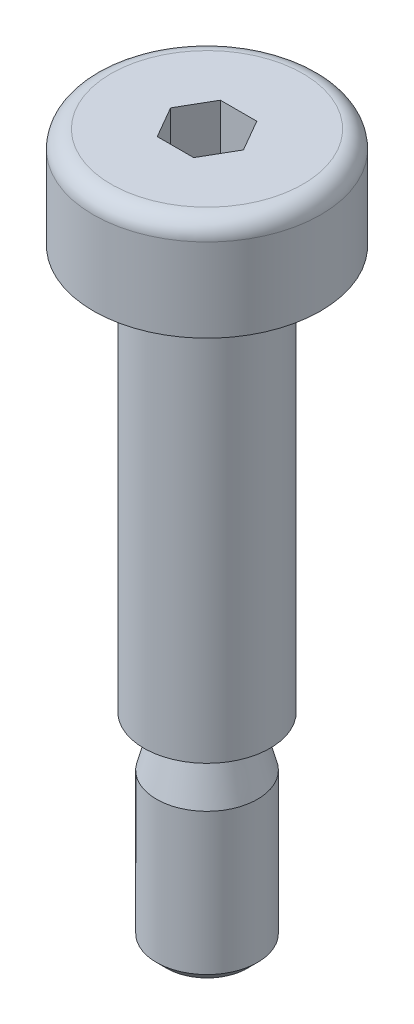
SolidWorks part; units mm, degrees
ref_plane "Aufriss" through (0, 0, 0) normal (0, 0, 1) x (1, 0, 0)
ref_plane "Grundriss" through (0, 0, 0) normal (0, 1, 0) x (1, 0, 0)
ref_plane "Seitenriss" through (0, 0, 0) normal (1, 0, 0) x (0, 0, -1)
sketch "Skizze1" plane through (0, 0, 0) normal (0, 0, 1) x (1, 0, 0)
  line L0 (0, 0) -> (-1.6, 0)
  line L1 (-2, 0.4) -> (-2, 6)
  line L2 (-2, 6) -> (-1.6, 7.4928)
  line L3 (-1.6, 7.4928) -> (-1.6, 8)
  line L4 (-1.6, 8) -> (-2.5, 8)
  line L5 (-2.5, 8) -> (-2.5, 24)
  line L6 (-2.5, 24) -> (-4.5, 24)
  line L7 (-4.5, 24) -> (-4.5, 27.3)
  line L8 (-3.8, 28) -> (0, 28)
  line L9 (0, 28) -> (0, 0) construction
  line L10 (0, 0) -> (0, 28)
  line L11 (-2, 0.4) -> (-1.6, 0)
  arc A0 (-4.5, 27.3) -> (-3.8, 28) centre (-3.8, 27.3) cw
  point P13 (-4.5, 28)
  dimension "D1" = 4
  dimension "D10" = 0.7
  dimension "D2" = 5
  dimension "D3" = 16
  dimension "D4" = 8
  dimension "D5" = 4
  dimension "D6" = 9
  dimension "D7" = 3.2
  dimension "D8" = 15
  dimension "D9" = 2
  dimension "D11" = 45
revolve "Rotation1" add sketch "Skizze1" angle 360 about L9
sketch "Skizze2" plane through (0, 28, 0) normal (0, 1, 0) x (1, 0, 0)
  line L1 (0.7217, 1.25) -> (-0.7217, 1.25)
  line L2 (-0.7217, 1.25) -> (-1.4434, 0)
  line L3 (-1.4434, 0) -> (-0.7217, -1.25)
  line L4 (-0.7217, -1.25) -> (0.7217, -1.25)
  line L5 (0.7217, -1.25) -> (1.4434, 0)
  line L6 (1.4434, 0) -> (0.7217, 1.25)
  circle A0 centre (0, 0) radius 1.25 construction
  dimension "D1" = 2.5
extrude "Schnitt-Linear austragen1" cut sketch "Skizze2" against normal blind 2
